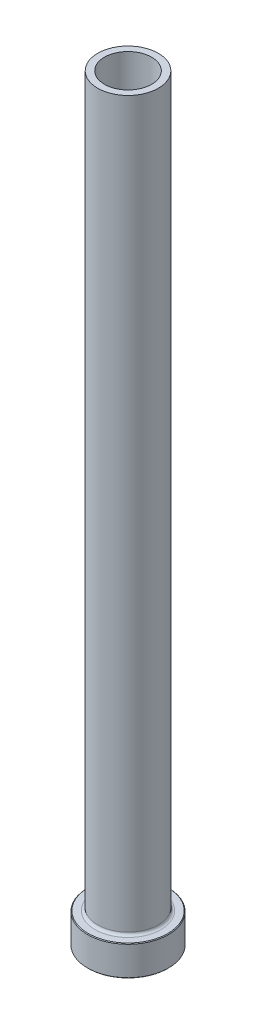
SolidWorks part; units mm, degrees
ref_plane "Front Plane" through (0, 0, 0) normal (0, 0, 1) x (1, 0, 0)
ref_plane "Top Plane" through (0, 0, 0) normal (0, 1, 0) x (1, 0, 0)
ref_plane "Right Plane" through (0, 0, 0) normal (1, 0, 0) x (0, 0, -1)
sketch "Sketch1" plane through (0, 0, 0) normal (0, 0, 1) x (1, 0, 0)
  line L0 (-7, 225) -> (-9, 225)
  line L1 (-9, 225) -> (-9, 9)
  line L2 (-9, 9) -> (-12, 9)
  line L3 (-12, 9) -> (-12, 0)
  line L4 (13.2, 0) -> (-13.2, 0) construction
  line L5 (-12, 0) -> (-7.25, 0)
  line L6 (-7, 170) -> (-7, 225)
  line L7 (0, 92.1877) -> (0, -15.5353) construction
  line L8 (0, -13.2) -> (0, 13.2) construction
  line L9 (-7, 170) -> (-7.25, 158)
  line L10 (-7.25, 158) -> (-7.25, 0)
  dimension "D1" = 0.25
  dimension "ID" = 14
  dimension "OD" = 18
  dimension "L" = 225
  dimension "H" = 24
  dimension "T" = 9
  dimension "N" = 55
  dimension "D2" = 12
revolve "Revolve1" add sketch "Sketch1" angle 360 about L7
fillet "Fillet1" radius 0.8 1 edges at (0, 9, 9)
chamfer "Chamfer1" distance 0.2 angle 45 2 edges at (0, 9, 12) (0, 0, 12)
chamfer "Chamfer3" distance 0.5 angle 45 1 edges at (0, 0, 7.25)
